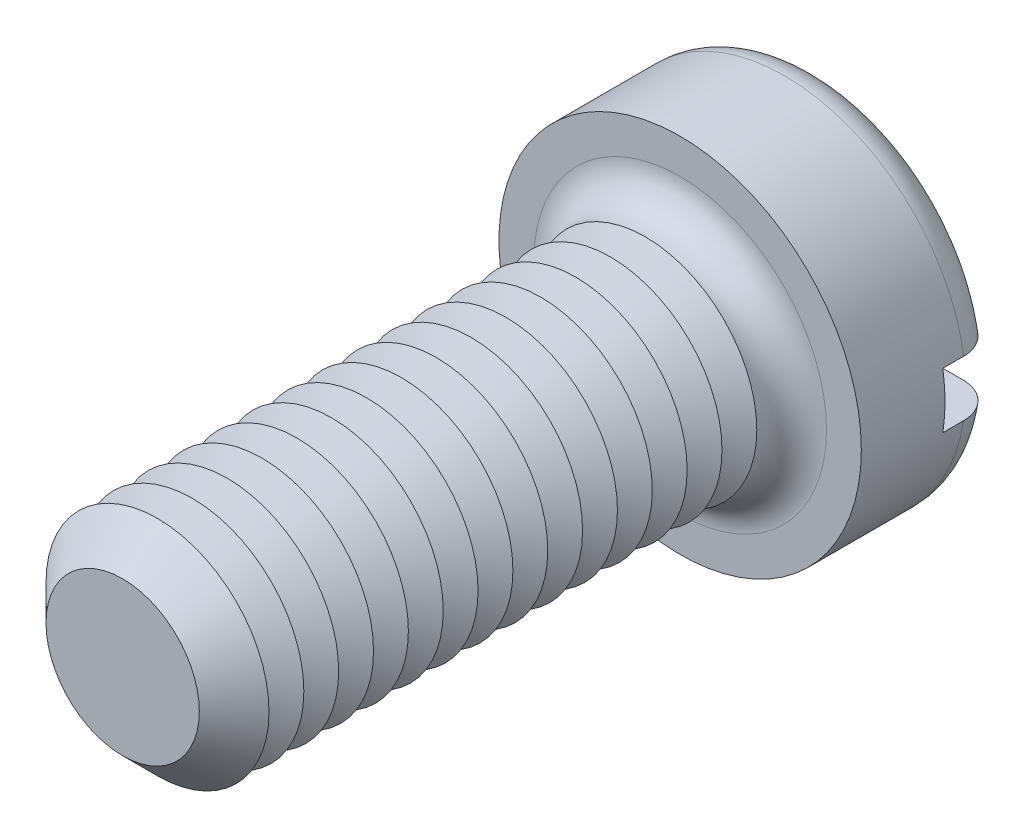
SolidWorks part; units mm, degrees
ref_plane "Front Plane" through (0, 0, 0) normal (0, 0, 1) x (1, 0, 0)
ref_plane "Top Plane" through (0, 0, 0) normal (0, 1, 0) x (1, 0, 0)
ref_plane "Right Plane" through (0, 0, 0) normal (1, 0, 0) x (0, 0, -1)
sketch "Sketch3" plane through (0, 0, 0) normal (0, 0, 1) x (1, 0, 0)
  circle A0 centre (0, 0) radius 6.5
  dimension "D1" = 13
extrude "Boss-Extrude2" add sketch "Sketch3" against normal blind 5
sketch "Sketch4" plane through (0, 0, 0) normal (0, 0, 1) x (1, 0, 0)
  circle A0 centre (0, 0) radius 4
  dimension "D1" = 8
extrude "Boss-Extrude3" add sketch "Sketch4" along normal blind 20
fillet "Fillet1" radius 1.25 2 edges at (6.5, 0, -5) (4, 0, 0)
chamfer "Chamfer1" distance 1.25 angle 45 1 edges at (4, 0, 20)
sketch "Sketch5" plane through (0, 0, 0) normal (1, 0, 0) x (0, 0, -1)
  line L0 (1.6944, 0) -> (-7.6738, 0) construction
sketch "Sketch6" plane through (0, 0, 0) normal (1, 0, 0) x (0, 0, -1)
  line L0 (-1.25, 4) -> (-1.875, 2.9175)
  line L1 (-1.875, 2.9175) -> (-2.5, 4)
  line L2 (-1.25, 4) -> (-18.75, 4) construction
  line L3 (-2.5, 4) -> (-1.25, 4)
  dimension "D1" = 1.25
revolve "Cut-Revolve1" cut sketch "Sketch6" angle 360 about L0
pattern_linear "LPattern1" count 14 spacing 1.25 along (0, 0, 1) of "Cut-Revolve1"
sketch "Sketch8" plane through (0, 0, -5) normal (0, 0, -1) x (-1, 0, 0)
  line L1 (6.5, -1) -> (-6.5, -1)
  line L2 (6.5, -1) -> (6.5, 1)
  line L3 (6.5, 1) -> (-6.5, 1)
  line L4 (-6.5, -1) -> (-6.5, 1)
  line L5 (6.5, -1) -> (-6.5, 1) construction
  line L6 (6.5, 1) -> (-6.5, -1) construction
  point P0 (0, 0)
  dimension "D1" = 13
  dimension "D2" = 2
extrude "Cut-Extrude1" cut sketch "Sketch8" against normal blind 2
